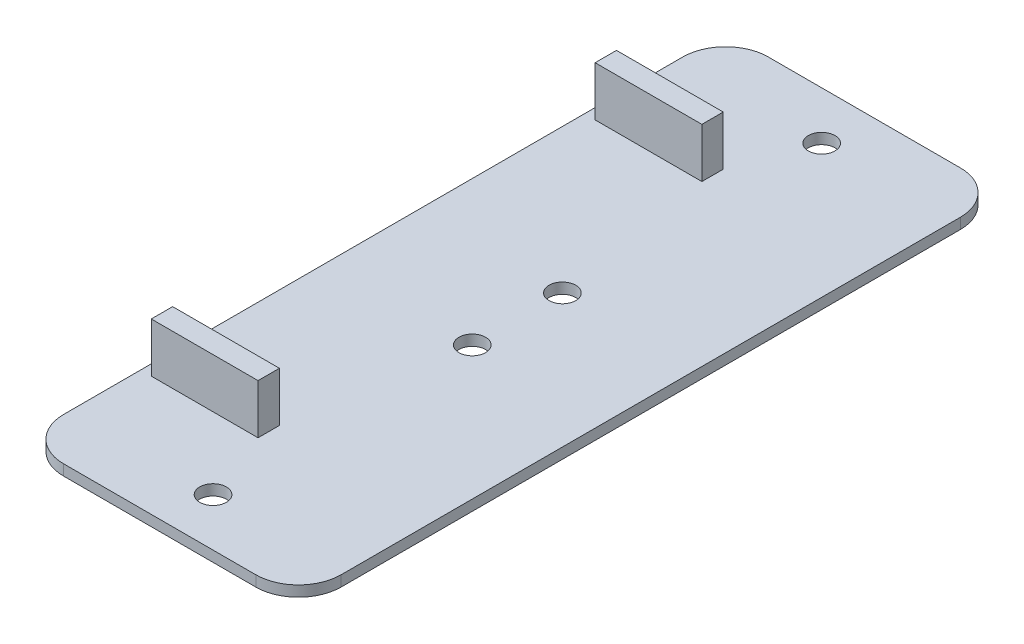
SolidWorks part; units mm, degrees
ref_plane "Front Plane" through (0, 0, 0) normal (0, 0, 1) x (1, 0, 0)
ref_plane "Top Plane" through (0, 0, 0) normal (0, 1, 0) x (1, 0, 0)
ref_plane "Right Plane" through (0, 0, 0) normal (1, 0, 0) x (0, 0, -1)
sketch "Sketch1" plane through (0, 0, 0) normal (0, 1, 0) x (1, 0, 0)
  line L1 (0, 0) -> (33.02, 0)
  line L2 (0, 0) -> (0, 83.82)
  line L3 (0, 83.82) -> (33.02, 83.82)
  line L4 (33.02, 0) -> (33.02, 83.82)
extrude "Boss-Extrude1" add sketch "Sketch1" along normal blind 1.27
sketch "Sketch2" plane through (0, 1.27, 0) normal (0, 1, 0) x (1, 0, 0)
  line L0 (17.145, 0) -> (17.145, 5.715) construction
  line L1 (0, 41.91) -> (33.02, 41.91) construction
  line L2 (17.145, 83.82) -> (17.145, 78.105) construction
  line L3 (0, 83.82) -> (0, 0) construction
  line L4 (17.145, 5.715) -> (17.145, 36.5506) construction
  line L17 (17.145, 78.105) -> (17.145, 47.2694) construction
  line L24 (17.145, 23.0669) -> (0, 23.0669) construction
  line L31 (0, 83.82) -> (0, 0) construction
  line L32 (0, 66.0029) -> (17.145, 66.0029) construction
  line L33 (33.02, 0) -> (33.02, 83.82) construction
  line L34 (16.51, 41.91) -> (16.51, 16.7831) construction
  line L35 (16.51, 41.91) -> (16.51, 67.037) construction
  line L41 (13.97, 16.7831) -> (1.27, 16.7831)
  line L42 (33.02, 16.0749) -> (13.97, 16.0749) construction
  line L43 (1.27, 16.7831) -> (1.27, 14.2431)
  line L44 (1.27, 14.2431) -> (13.97, 14.2431)
  line L45 (13.97, 14.2431) -> (13.97, 16.7831)
  line L46 (33.02, 68.0489) -> (13.97, 68.0489) construction
  line L47 (13.97, 67.037) -> (13.97, 69.5769)
  line L48 (13.97, 69.5769) -> (1.27, 69.5769)
  line L49 (1.27, 69.5769) -> (1.27, 67.037)
  line L50 (1.27, 67.037) -> (13.97, 67.037)
sketch "Sketch3" plane through (0, 1.27, 0) normal (0, 1, 0) x (1, 0, 0)
  line L0 (18.9048, 81.153) -> (15.3852, 75.057) construction
  line L3 (15.3852, 44.2214) -> (18.9048, 50.3174) construction
  line L4 (15.3852, 33.5026) -> (18.9048, 39.5986) construction
  line L5 (15.3852, 2.667) -> (18.9048, 8.763) construction
  circle A0 centre (17.145, 78.105) radius 1.5875
  circle A1 centre (17.145, 47.2694) radius 1.5875
  circle A2 centre (17.145, 36.5506) radius 1.5875
  circle A3 centre (17.145, 5.715) radius 1.5875
extrude "Cut-Extrude1" cut sketch "Sketch3" against normal through all both and the other way through all from surface at 0
fillet "Fillet1" radius 5.08 1 edges at (0, 0.635, 0)
fillet "Fillet2" radius 5.08 1 edges at (33.02, 0.635, 0)
fillet "Fillet3" radius 5.08 1 edges at (33.02, 0.635, -83.82)
fillet "Fillet4" radius 5.08 1 edges at (0, 0.635, -83.82)
extrude "Boss-Extrude2" add sketch "Sketch2" along normal blind 5.8928
equation "\"0.5n\"=0.1"
